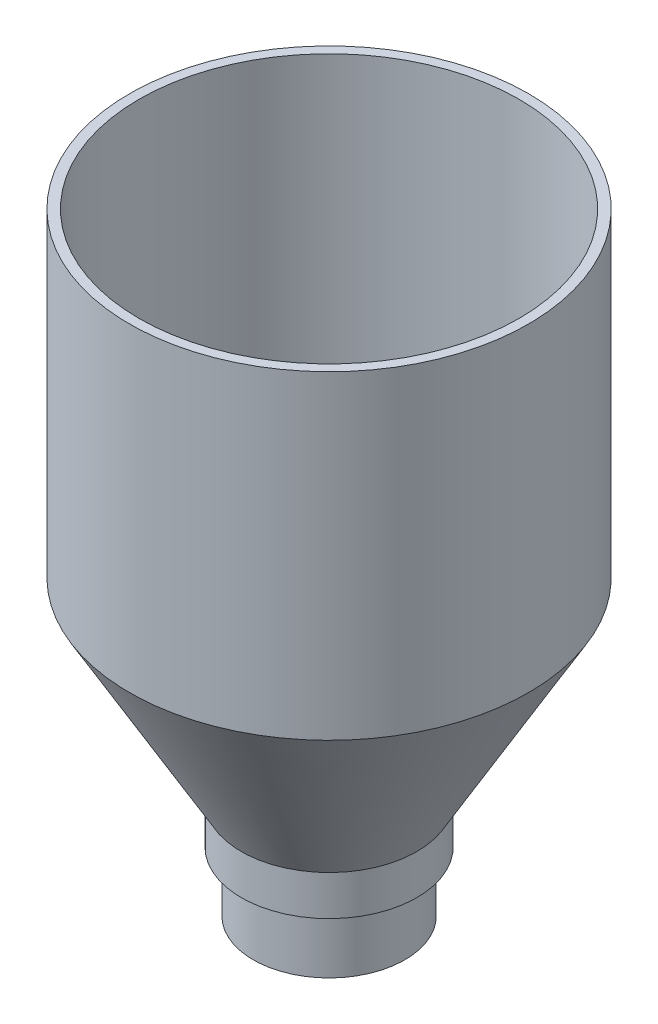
SolidWorks part; units mm, degrees
ref_plane "Front Plane" through (0, 0, 0) normal (0, 0, 1) x (1, 0, 0)
ref_plane "Top Plane" through (0, 0, 0) normal (0, 1, 0) x (1, 0, 0)
ref_plane "Right Plane" through (0, 0, 0) normal (1, 0, 0) x (0, 0, -1)
sketch "Esquisse2" plane through (0, 0, 0) normal (0, 0, 1) x (1, 0, 0)
  line L0 (-11, 7.5) -> (-11, 12.5)
  line L1 (-11, 12.5) -> (-25, 36.7487)
  line L2 (-25, 36.7487) -> (-25, 76.7487)
  line L3 (-25, 76.7487) -> (-23.8, 76.7487)
  line L4 (0, -4.536) -> (0, 61.4385) construction
  line L5 (-23.8, 76.7487) -> (-23.8, 37.0703)
  line L6 (-11, 7.5) -> (-9.5, 7.5)
  line L7 (-9.5, 7.5) -> (-9.5, 0)
  line L8 (-23.8, 37.0703) -> (-9.1019, 11.6124)
  line L10 (-8, 0) -> (-9.5, 0)
  line L11 (-8, 7.5) -> (-8, 0)
  arc A0 (-9.1019, 11.6124) -> (-8, 7.5) centre (-16.2249, 7.5) cw
revolve "Révolution1" add sketch "Esquisse2" angle 360 about L4
equation "\"D5@Esquisse2\"=\"D4@Esquisse2\""
